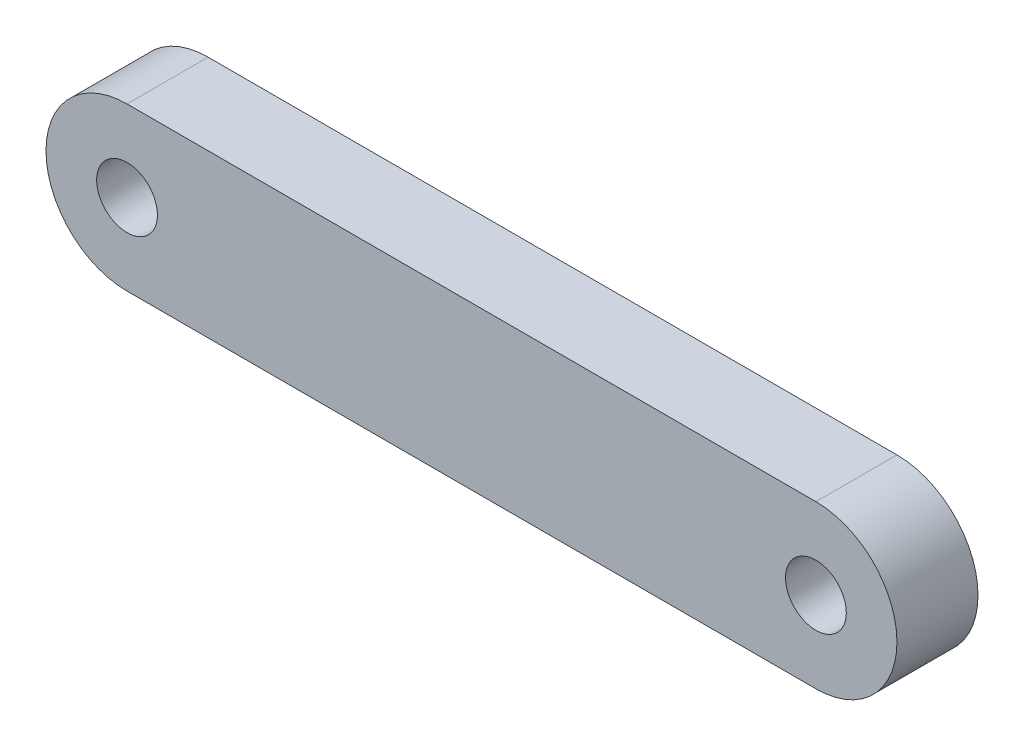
SolidWorks part; units mm, degrees
ref_plane "前视基准面" through (0, 0, 0) normal (0, 0, 1) x (1, 0, 0)
ref_plane "上视基准面" through (0, 0, 0) normal (0, 1, 0) x (1, 0, 0)
ref_plane "右视基准面" through (0, 0, 0) normal (1, 0, 0) x (0, 0, -1)
sketch "草图1" plane through (0, 0, 0) normal (0, 0, 1) x (1, 0, 0)
  line L0 (15, 4) -> (49, 4)
  line L3 (15, -4) -> (49, -4)
  line L5 (39.1223, -1.6393) -> (39.1223, -1.5638)
  line L6 (39.1223, -1.5638) -> (39.1223, -1.4884)
  circle A1 centre (49, 0) radius 1.5
  arc A2 (15, 4) -> (15, -4) centre (15, 0) ccw
  circle A3 centre (15, 0) radius 1.5
  arc A4 (49, -4) -> (49, 4) centre (49, 0) ccw
  point P2 (0, 0)
extrude "凸台-拉伸1" add sketch "草图1" along normal blind 4
